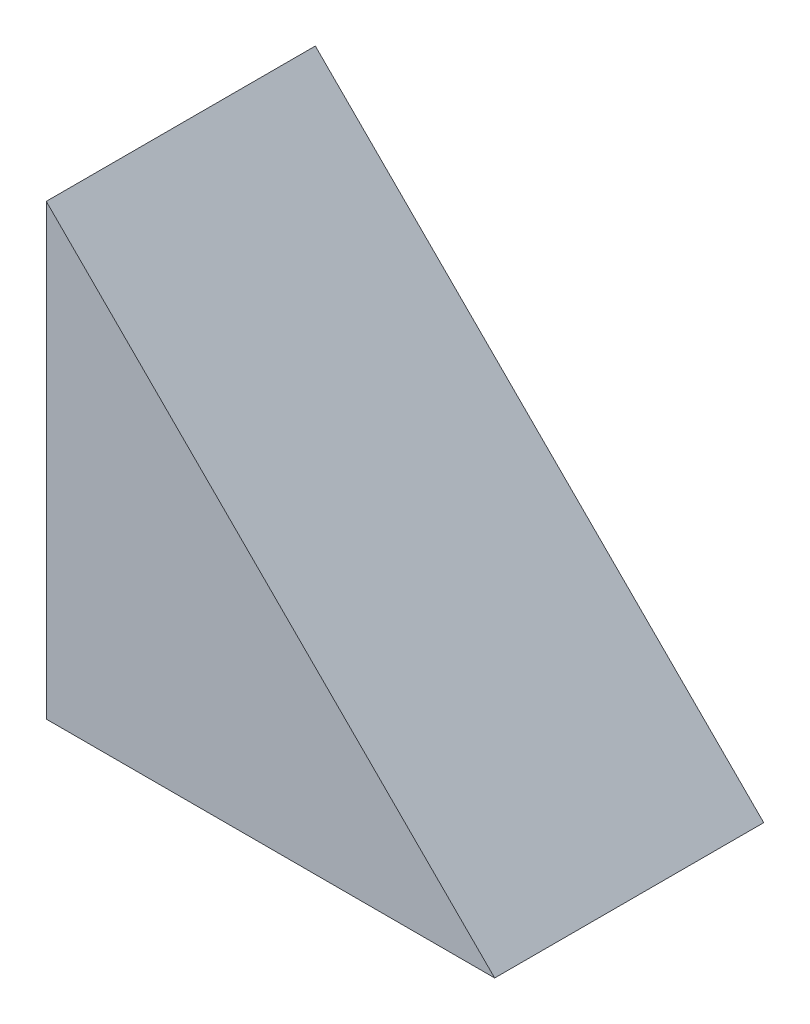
SolidWorks part; units mm, degrees
ref_plane "Front Plane" through (0, 0, 0) normal (0, 0, 1) x (1, 0, 0)
ref_plane "Top Plane" through (0, 0, 0) normal (0, 1, 0) x (1, 0, 0)
ref_plane "Right Plane" through (0, 0, 0) normal (1, 0, 0) x (0, 0, -1)
sketch "Sketch1" plane through (0, 0, 0) normal (0, 0, 1) x (1, 0, 0)
  line L0 (0, 20) -> (20, 0)
  line L1 (0, 0) -> (20, 0)
  line L2 (0, 0) -> (0, 20)
  line L3 (0, 20) -> (20, 20)
  line L4 (20, 0) -> (20, 20)
  dimension "D1" = 20
  dimension "D2" = 20
extrude "Boss-Extrude1" add sketch "Sketch1" along normal blind 12 contours L2 L1 L0
